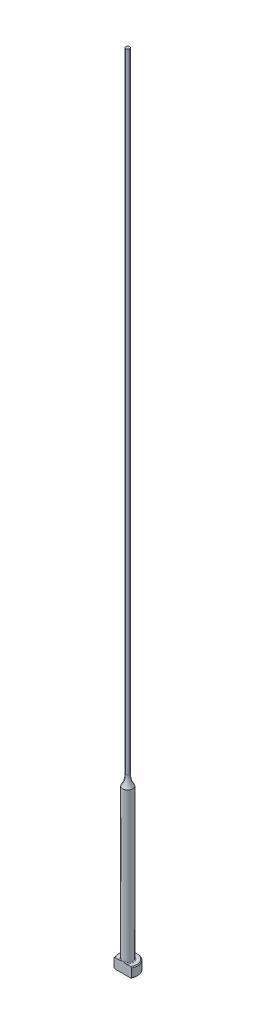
SolidWorks part; units mm, degrees
ref_plane "Front Plane" through (0, 0, 0) normal (0, 0, 1) x (1, 0, 0)
ref_plane "Top Plane" through (0, 0, 0) normal (0, 1, 0) x (1, 0, 0)
ref_plane "Right Plane" through (0, 0, 0) normal (1, 0, 0) x (0, 0, -1)
sketch "Sketch1" plane through (0, 0, 0) normal (0, 0, 1) x (1, 0, 0)
  line L0 (0, 259.9588) -> (0, -15.1925) construction
  line L1 (0, 0) -> (-3.175, 0)
  line L2 (-3.175, 0) -> (-3.175, 3.175)
  line L3 (-3.175, 3.175) -> (-1.5875, 3.175)
  line L4 (-0.5944, 54.2098) -> (-0.5944, 254)
  line L5 (-0.5944, 254) -> (0, 254)
  line L6 (0, 254) -> (0, 0)
  line L7 (-1.5875, 3.175) -> (-1.5875, 50.8)
  arc A0 (-1.5875, 50.8) -> (-0.5944, 54.2098) centre (-6.9444, 54.2098) ccw
  point P13 (-1.5875, 0)
  dimension "D1" = 6.35
  dimension "L" = 254
  dimension "D2" = 3.175
  dimension "H" = 6.35
  dimension "T" = 3.175
  dimension "D" = 1.1887
  dimension "S" = 50.8
revolve "Revolve1" add sketch "Sketch1" angle 360 about L0
chamfer "Chamfer1" distance 0.254 angle 45 2 edges at (0, 3.175, 3.175) (0, 0, 3.175)
fillet "Fillet1" radius 0.254 1 edges at (0, 3.175, 1.5875)
sketch "Sketch2" plane through (0, 0, 0) normal (0, -1, 0) x (1, 0, 0)
  line L0 (-2.7496, 1.5875) -> (2.7496, 1.5875)
  circle A0 centre (0, 0) radius 3.175 construction
  arc A1 (2.7496, 1.5875) -> (-2.7496, 1.5875) centre (0, 0) ccw
  circle A4 centre (0, 0) radius 1.5875 construction
  dimension "D1" = 0
extrude "KEY" cut sketch "Sketch2" against normal through all
